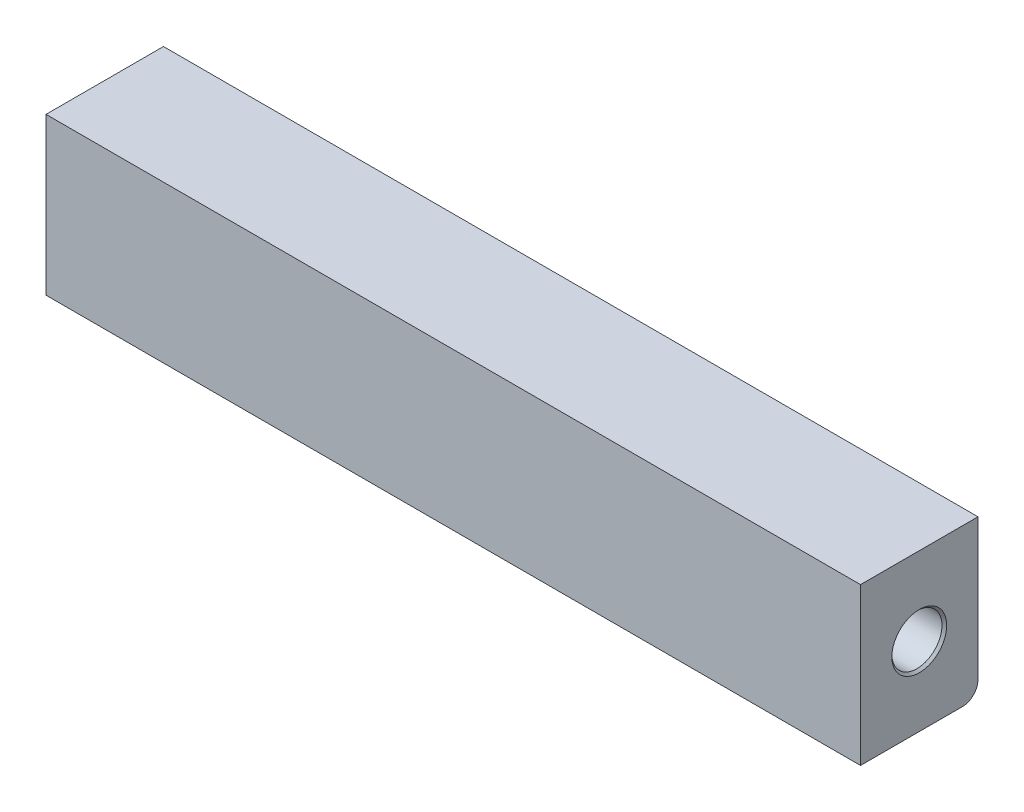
SolidWorks part; units mm, degrees
ref_plane "Piano frontale" through (0, 0, 0) normal (0, 0, 1) x (1, 0, 0)
ref_plane "Piano superiore" through (0, 0, 0) normal (0, 1, 0) x (1, 0, 0)
ref_plane "Piano destro" through (0, 0, 0) normal (1, 0, 0) x (0, 0, -1)
sketch "Schizzo2" plane through (0, 0, 0) normal (0, 1, 0) x (1, 0, 0)
  line L1 (-52, 7.5) -> (52, 7.5)
  line L2 (-52, 7.5) -> (-52, -7.5)
  line L3 (-52, -7.5) -> (52, -7.5)
  line L4 (52, 7.5) -> (52, -7.5)
  line L5 (-52, 7.5) -> (52, -7.5) construction
  line L6 (-52, -7.5) -> (52, 7.5) construction
  point P0 (0, 0)
extrude "Estrusione-Estrusione1" add sketch "Schizzo2" along normal blind 20
fillet "Raccordo1" radius 2 1 edges at (0, 0, -7.5)
hole_wizard "Foro per Vite M6-1" positions "Schizzo4" profile "Schizzo3" hole size "M6" standard "ISO"
sketch "Schizzo4" plane through (-52, 0, 0) normal (-1, 0, 0) x (0, 0, 1)
  point P0 (0, 10)
sketch "Schizzo3" plane through (-52, 10, 0) normal (0, 1, 0) x (0, 0, 1)
  line L0 (0, 0) -> (0, 31.9228)
  line L1 (0, 31.9228) -> (3.2, 30)
  line L2 (3.2, 30) -> (3.2, 0.3)
  line L3 (3.2, 0.3) -> (3.5, 0)
  line L5 (3.5, 0) -> (0, 0)
  line L6 (-3.2, 0.3) -> (-3.5, 0) construction
  line L10 (0, 31.9228) -> (-3.2, 30) construction
  line L11 (0, -6.35) -> (0, 107.95) construction
  dimension "Hole Dia." = 6.4
  dimension "Hole Depth" = 30
  dimension "Near C'Sink Dia." = 7
  dimension "Near C'Sink Angle" = 90
  dimension "Drill Angle" = 118
hole_wizard "Foro per Vite M6-2" positions "Schizzo7" profile "Schizzo6" hole size "M6" standard "ISO"
sketch "Schizzo7" plane through (52, 0, 0) normal (1, 0, 0) x (0, 0, -1)
  point P0 (0, 10)
sketch "Schizzo6" plane through (52, 10, 0) normal (0, 1, 0) x (0, 0, -1)
  line L0 (0, 0) -> (0, 31.9228)
  line L1 (0, 31.9228) -> (3.2, 30)
  line L2 (3.2, 30) -> (3.2, 0.3)
  line L3 (3.2, 0.3) -> (3.5, 0)
  line L5 (3.5, 0) -> (0, 0)
  line L6 (-3.2, 0.3) -> (-3.5, 0) construction
  line L10 (0, 31.9228) -> (-3.2, 30) construction
  line L11 (0, -6.35) -> (0, 107.95) construction
  dimension "Hole Dia." = 6.4
  dimension "Hole Depth" = 30
  dimension "Near C'Sink Dia." = 7
  dimension "Near C'Sink Angle" = 90
  dimension "Drill Angle" = 118
